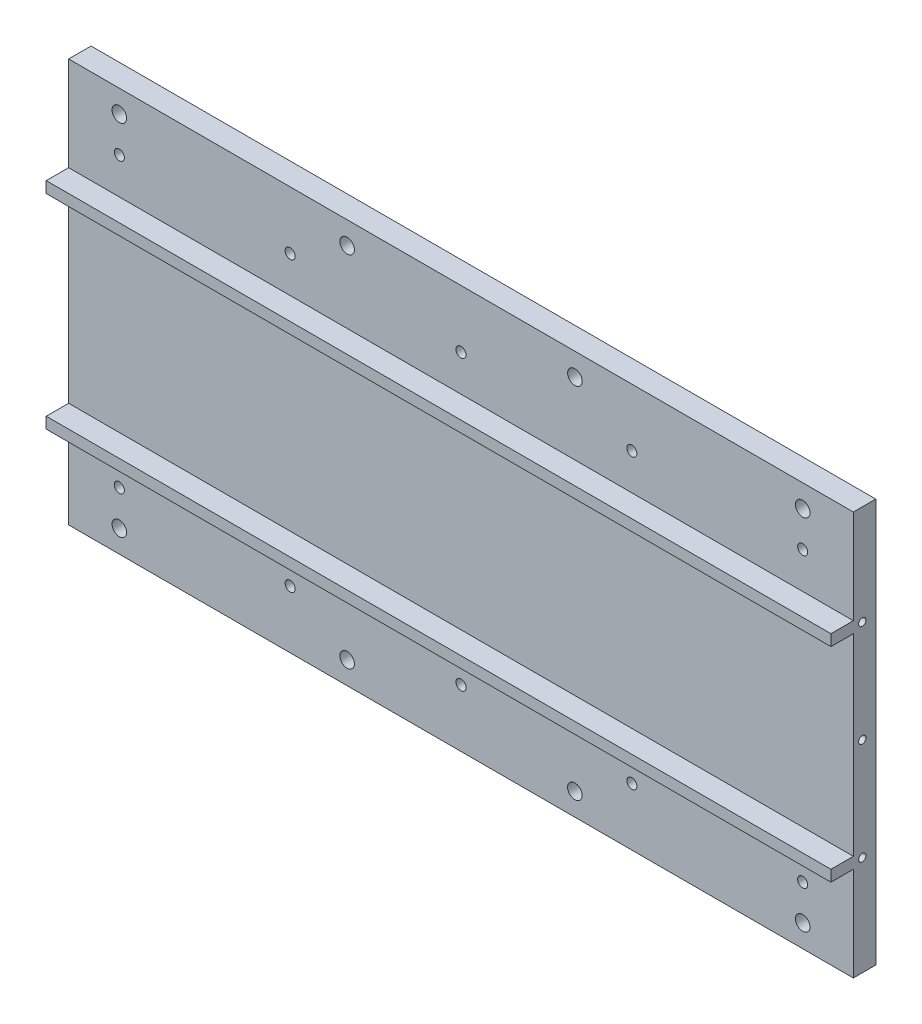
SolidWorks part; units mm, degrees
ref_plane "Front Plane" through (0, 0, 0) normal (0, 0, 1) x (1, 0, 0)
ref_plane "Top Plane" through (0, 0, 0) normal (0, 1, 0) x (1, 0, 0)
ref_plane "Right Plane" through (0, 0, 0) normal (1, 0, 0) x (0, 0, -1)
sketch "Sketch1" plane through (0, 0, 0) normal (0, 0, 1) x (1, 0, 0)
  line L1 (-175, 90) -> (175, 90)
  line L2 (-175, 90) -> (-175, -90)
  line L3 (-175, -90) -> (175, -90)
  line L4 (175, 90) -> (175, -90)
  point P4 (175, 0)
  point P6 (0, 90)
  dimension "D1" = 180
  dimension "D2" = 350
extrude "Boss-Extrude1" add sketch "Sketch1" along normal blind 10
sketch "Sketch2" plane through (0, 0, 10) normal (0, 0, 1) x (1, 0, 0)
  line L0 (-175, 90) -> (-175, -90) construction
  line L1 (-175, 48) -> (175, 48)
  line L2 (-175, 48) -> (-175, 43)
  line L3 (-175, 43) -> (175, 43)
  line L4 (175, 48) -> (175, 43)
  line L5 (175, -90) -> (175, 90) construction
  dimension "D1" = 5
  dimension "D2" = 43
extrude "Boss-Extrude2" add sketch "Sketch2" along normal blind 10
hole_wizard "Ø6.5 (6.5) Diameter Slot1" positions "Sketch3" profile "Sketch5" size "Ø6.5" standard "ANSI Metric"
sketch "Sketch3" plane through (0, 0, 10) normal (0, 0, 1) x (1, 0, 0)
  line L0 (175, 48) -> (175, 90) construction
  line L1 (11, 0) -> (-11, 0) construction
  point P0 (152.4, 80)
  dimension "D1" = 22.6
  dimension "D2" = 80
sketch "Sketch5" plane through (152.4, 80, 10) normal (1, 0, 0) x (0, -1, 0)
  line L0 (0, 0) -> (0, 10)
  line L1 (0, 10) -> (3.25, 10)
  line L2 (3.25, 10) -> (3.25, 0)
  line L5 (3.25, 0) -> (0, 0)
  line L11 (0, -6.35) -> (0, 107.95) construction
  dimension "Thru Hole Dia." = 6.5
  dimension "Thru Hole Depth" = 10
hole_wizard "CBORE for M4 SHCS1" positions "Sketch6" profile "Sketch7" counterbore size "M4" standard "ANSI Metric"
sketch "Sketch6" plane through (0, 0, 0) normal (0, 0, -1) x (-1, 0, 0)
  line L0 (-175, -90) -> (-175, 90) construction
  line L1 (11, 0) -> (-11, 0) construction
  point P0 (-152.4, 64.25)
  dimension "D1" = 22.6
  dimension "D2" = 64.25
sketch "Sketch7" plane through (152.4, 64.25, 0) normal (1, 0, 0) x (0, 1, 0)
  line L0 (0, 0) -> (0, 20)
  line L1 (0, 20) -> (2.25, 20)
  line L3 (2.25, 20) -> (2.25, 4.5)
  line L4 (2.25, 4.5) -> (4, 4.5)
  line L5 (4, 4.5) -> (4, 0)
  line L7 (4, 0) -> (0, 0)
  line L11 (0, -6.35) -> (0, 107.95) construction
  dimension "Thru Hole Dia." = 4.5
  dimension "Thru Hole Depth" = 20
  dimension "C'Bore Dia." = 8
  dimension "C'Bore Depth" = 4.5
pattern_linear "LPattern1" count 4 spacing 101.6 along (-1, 0, 0) of "Ø6.5 (6.5) Diameter Slot1"
pattern_linear "LPattern2" count 5 spacing 76.2 along (-1, 0, 0) of "CBORE for M4 SHCS1"
mirror "Mirror1" about plane through (0, 0, 0) normal (0, 1, 0) of "CBORE for M4 SHCS1", "LPattern2", "LPattern1", "Ø6.5 (6.5) Diameter Slot1", "Boss-Extrude2"
hole_wizard "M4x0.7 Tapped Hole1" positions "Sketch8" profile "Sketch10" tap size "M4x0.7" standard "ANSI Metric"
sketch "Sketch8" plane through (175, 0, 0) normal (1, 0, 0) x (0, 0, -1)
  line L0 (0, -90) -> (0, 90) construction
  point P0 (-6, 0)
  point P7 (0, 0)
  dimension "D1" = 6
sketch "Sketch10" plane through (175, 0, 6) normal (0, 1, 0) x (0, 0, -1)
  line L0 (0, 0) -> (0, 12.9914)
  line L1 (0, 12.9914) -> (1.65, 12)
  line L2 (1.65, 12) -> (1.65, 0)
  line L5 (1.65, 0) -> (0, 0)
  line L10 (0, 12.9914) -> (-1.65, 12) construction
  line L11 (0, -6.35) -> (0, 107.95) construction
  dimension "Tap Drill Dia." = 3.3
  dimension "Tap Drill Depth" = 12
  dimension "Drill Angle" = 118
pattern_linear "LPattern3" count 2 spacing 45.5 along (0, 1, 0) count 2 spacing 45.5 along (0, -1, 0) of "M4x0.7 Tapped Hole1"
mirror "Mirror2" about plane through (0, 0, 0) normal (1, 0, 0) of "LPattern3", "M4x0.7 Tapped Hole1"
